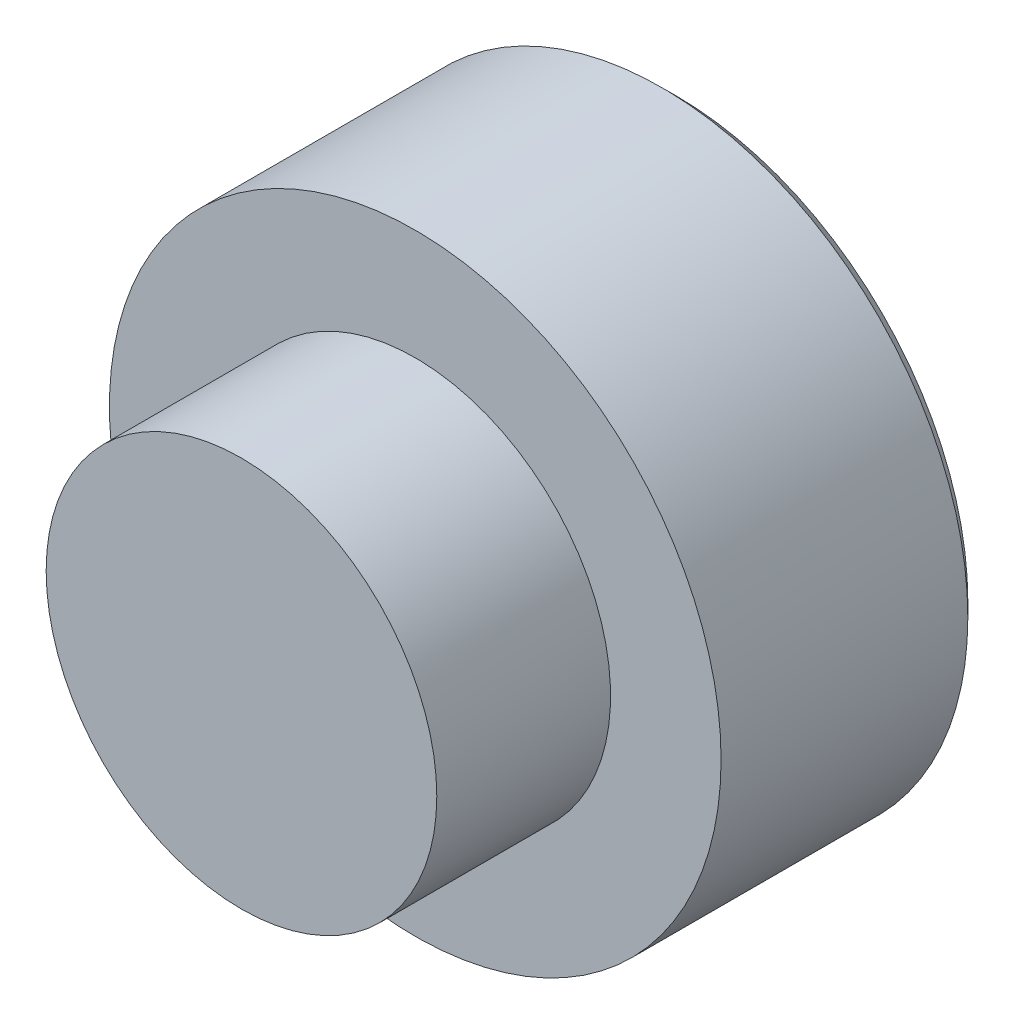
SolidWorks part; units mm, degrees
ref_plane "Front Plane" through (0, 0, 0) normal (0, 0, 1) x (1, 0, 0)
ref_plane "Top Plane" through (0, 0, 0) normal (0, 1, 0) x (1, 0, 0)
ref_plane "Right Plane" through (0, 0, 0) normal (1, 0, 0) x (0, 0, -1)
sketch "Sketch1" plane through (0, 0, 0) normal (0, 0, 1) x (1, 0, 0)
  circle A0 centre (0, 0) radius 3.5687
  dimension "D1" = 7.1374
extrude "Boss-Extrude1" add sketch "Sketch1" along normal blind 3.175
sketch "Sketch2" plane through (0, 0, 0) normal (0, 0, -1) x (-1, 0, 0)
  circle A0 centre (0, 0) radius 5.588
  dimension "D1" = 11.176
extrude "Boss-Extrude2" add sketch "Sketch2" along normal blind 4.7625
chamfer "Chamfer1" distance 0.254 angle 45 1 edges at (-5.588, 0, -4.7625)
